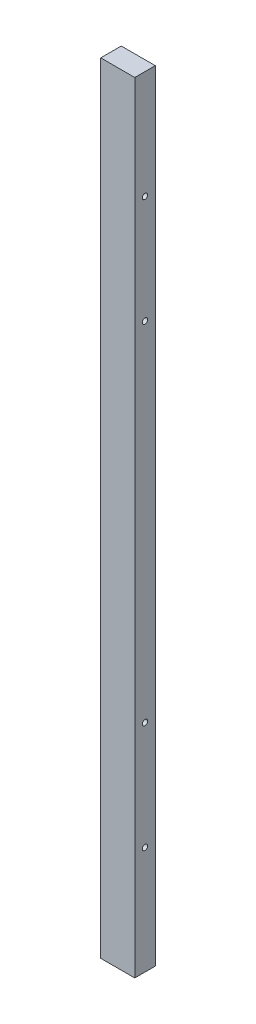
SolidWorks part; units mm, degrees
ref_plane "Front Plane" through (0, 0, 0) normal (0, 0, 1) x (1, 0, 0)
ref_plane "Top Plane" through (0, 0, 0) normal (0, 1, 0) x (1, 0, 0)
ref_plane "Right Plane" through (0, 0, 0) normal (1, 0, 0) x (0, 0, -1)
sketch "Sketch1" plane through (0, 0, 0) normal (0, 0, 1) x (1, 0, 0)
  line L1 (0, 0) -> (63, 0)
  line L2 (0, 0) -> (0, 1444)
  line L3 (0, 1444) -> (63, 1444)
  line L4 (63, 0) -> (63, 1444)
  dimension "D1" = 1444
  dimension "D2" = 63
extrude "Boss-Extrude1" add sketch "Sketch1" along normal blind 38
sketch "Sketch2" plane through (0, 0, 0) normal (-1, 0, 0) x (0, 0, 1)
  line L0 (19, 1444) -> (19, 0) construction
  line L1 (38, 1444) -> (0, 1444) construction
  line L2 (38, 0) -> (0, 0) construction
  line L3 (19, 1244) -> (19, 1044) construction
  line L4 (38, 722) -> (0, 722) construction
  line L5 (38, 1444) -> (38, 0) construction
  line L6 (0, 1444) -> (0, 0) construction
  circle A1 centre (19, 1244) radius 5
  circle A2 centre (19, 1044) radius 5
  circle A3 centre (19, 200) radius 5
  circle A4 centre (19, 400) radius 5
extrude "Cut-Extrude1" cut sketch "Sketch2" against normal up to next
equation "\"Hole Diameter\"= 10"
equation "\"D1@Sketch2\"=\"Hole Diameter\""
